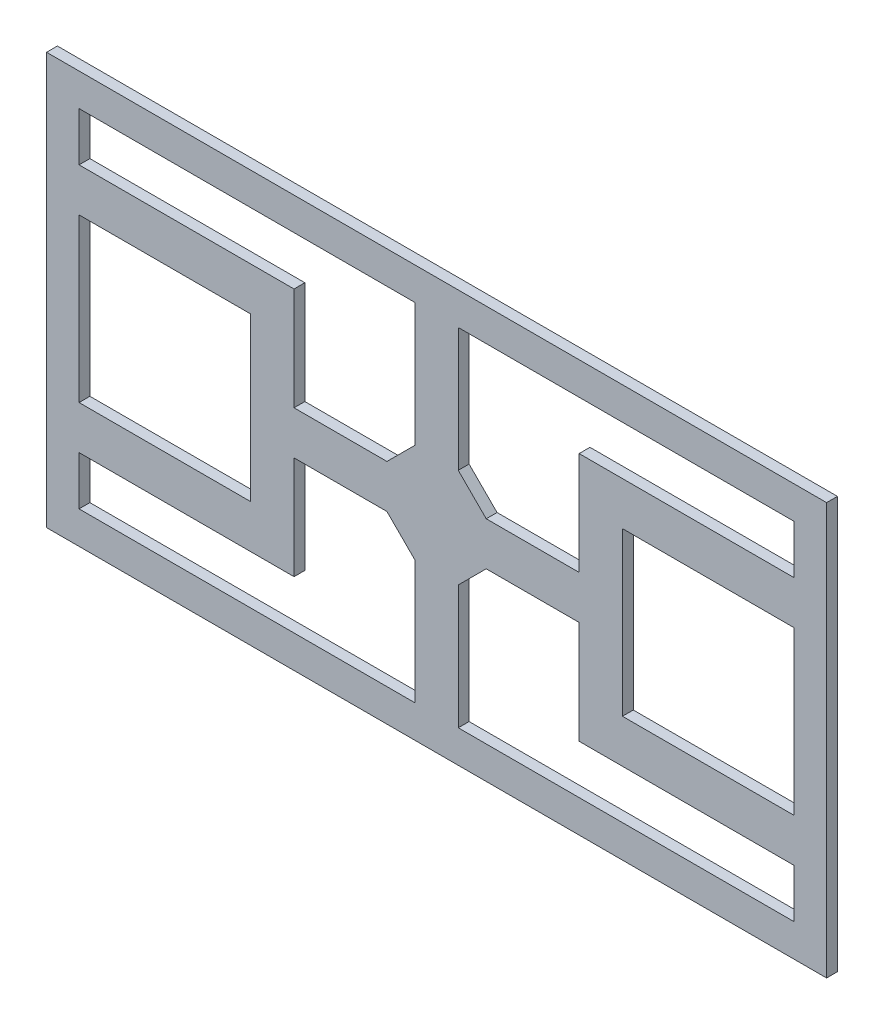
SolidWorks part; units mm, degrees
ref_plane "Front Plane" through (0, 0, 0) normal (0, 0, 1) x (1, 0, 0)
ref_plane "Top Plane" through (0, 0, 0) normal (0, 1, 0) x (1, 0, 0)
ref_plane "Right Plane" through (0, 0, 0) normal (1, 0, 0) x (0, 0, -1)
sketch "Sketch1" plane through (0, 0, 0) normal (0, 0, 1) x (1, 0, 0)
  line L0 (0, -1431.8) -> (0, -215.9) construction
  line L1 (0, 0) -> (63.5, 0) construction
  line L2 (-419.1, 203.2) -> (-25.4, 203.2)
  line L4 (-457.2, -241.3) -> (-457.2, 241.3)
  line L5 (-457.2, 241.3) -> (457.2, 241.3)
  line L7 (-419.1, 120.65) -> (-362.2033, 120.65) construction
  line L8 (-457.2, 241.3) -> (0, 0) construction
  line L11 (-419.1, -95.25) -> (-419.1, 95.25)
  line L12 (-419.1, 95.25) -> (-217.9053, 95.25)
  line L13 (-419.1, 146.05) -> (-167.1053, 146.05)
  line L14 (-167.1053, 146.05) -> (-167.1053, 25.4)
  line L15 (-217.9053, 95.25) -> (-217.9053, -95.25)
  line L16 (-192.5053, 103.0672) -> (-192.5053, 170.331) construction
  line L17 (0, -63.5) -> (0, 1215.9) construction
  line L18 (-167.1053, 25.4) -> (-58.1987, 25.4)
  line L19 (-25.4, 203.2) -> (-25.4, 58.1987)
  line L20 (-419.1, 146.05) -> (-419.1, 203.2)
  line L21 (-58.1987, 25.4) -> (-25.4, 58.1987)
  line L22 (419.1, 146.05) -> (419.1, 203.2)
  line L23 (419.1, 146.05) -> (167.1053, 146.05)
  line L24 (25.4, 203.2) -> (25.4, 58.1987)
  line L25 (58.1987, 25.4) -> (25.4, 58.1987)
  line L26 (167.1053, 25.4) -> (58.1987, 25.4)
  line L27 (167.1053, 146.05) -> (167.1053, 25.4)
  line L28 (217.9053, 95.25) -> (217.9053, -95.25)
  line L29 (419.1, -95.25) -> (419.1, 95.25)
  line L30 (419.1, 95.25) -> (217.9053, 95.25)
  line L31 (457.2, -241.3) -> (457.2, 241.3)
  line L32 (419.1, 203.2) -> (25.4, 203.2)
  line L33 (-419.1, -146.05) -> (-419.1, -203.2)
  line L34 (-419.1, -146.05) -> (-167.1053, -146.05)
  line L35 (-419.1, -203.2) -> (-25.4, -203.2)
  line L36 (-419.1, -95.25) -> (-217.9053, -95.25)
  line L37 (-167.1053, -146.05) -> (-167.1053, -25.4)
  line L38 (-167.1053, -25.4) -> (-58.1987, -25.4)
  line L39 (-58.1987, -25.4) -> (-25.4, -58.1987)
  line L40 (-25.4, -203.2) -> (-25.4, -58.1987)
  line L41 (25.4, -203.2) -> (25.4, -58.1987)
  line L42 (58.1987, -25.4) -> (25.4, -58.1987)
  line L43 (167.1053, -25.4) -> (58.1987, -25.4)
  line L44 (419.1, -146.05) -> (167.1053, -146.05)
  line L45 (167.1053, -146.05) -> (167.1053, -25.4)
  line L46 (419.1, -95.25) -> (217.9053, -95.25)
  line L47 (419.1, -146.05) -> (419.1, -203.2)
  line L48 (419.1, -203.2) -> (25.4, -203.2)
  line L49 (-457.2, -241.3) -> (457.2, -241.3)
  arc A1 (0, 63.5) -> (-63.5, 0) centre (0, 0) ccw construction
  point P13 (-419.1, 127.6588)
  point P42 (0, 241.3)
  point P47 (-457.2, 0)
  point P48 (-419.1, 0)
  point P49 (-217.9053, 0)
  point P59 (217.9053, 0)
  point P60 (419.1, 0)
  point P61 (457.2, 0)
  dimension "D1" = 63.5
  dimension "D2" = 241.3
  dimension "D3" = 457.2
  dimension "D4" = 38.1
  dimension "D5" = 25.4
  dimension "D6" = 251.9947
  dimension "D7" = 38.1
  dimension "D8" = 25.4
  dimension "D9" = 25.4
  dimension "D10" = 25.4
  dimension "D11" = 25.4
  dimension "D12" = 25.4
  dimension "D13" = 120.65
extrude "Boss-Extrude1" add sketch "Sketch1" along normal blind 12.7
